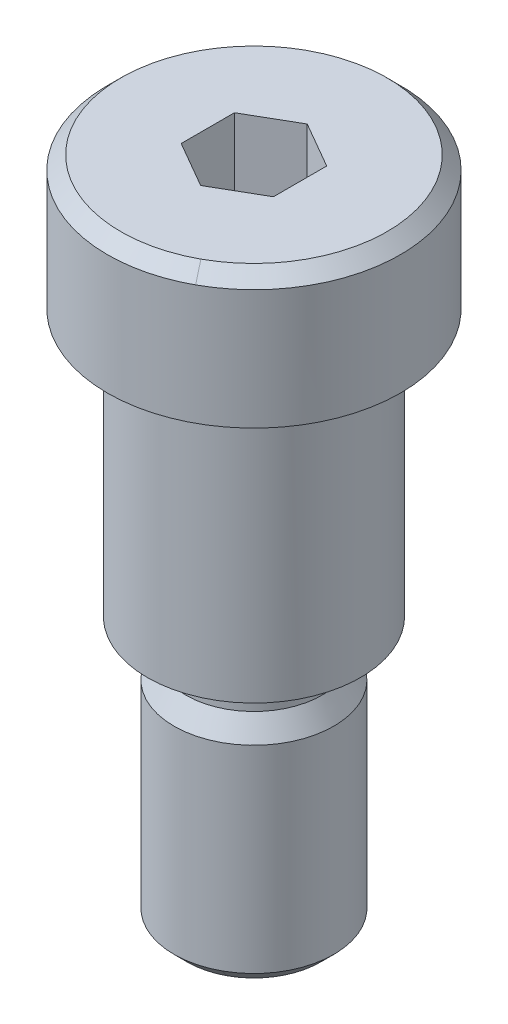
SolidWorks part; units mm, degrees
ref_plane "Plan de face" through (0, 0, 0) normal (0, 0, 1) x (1, 0, 0)
ref_plane "Plan de dessus" through (0, 0, 0) normal (0, 1, 0) x (1, 0, 0)
ref_plane "Plan de droite" through (0, 0, 0) normal (1, 0, 0) x (0, 0, -1)
imported_body "Importée1"
sketch "Esquisse1" plane through (0, 0, 0) normal (0, 1, 0) x (-1, 0, 0)
  line L1 (3.4641, -2) -> (3.4641, 2)
  line L2 (3.4641, 2) -> (0, 4)
  line L3 (0, 4) -> (-3.4641, 2)
  line L4 (-3.4641, 2) -> (-3.4641, -2)
  line L5 (-3.4641, -2) -> (0, -4)
  line L6 (0, -4) -> (3.4641, -2)
  circle A0 centre (0, 0) radius 3.4641 construction
extrude "Enlèv. mat.-Extru.1" cut sketch "Esquisse1" against normal blind 6
